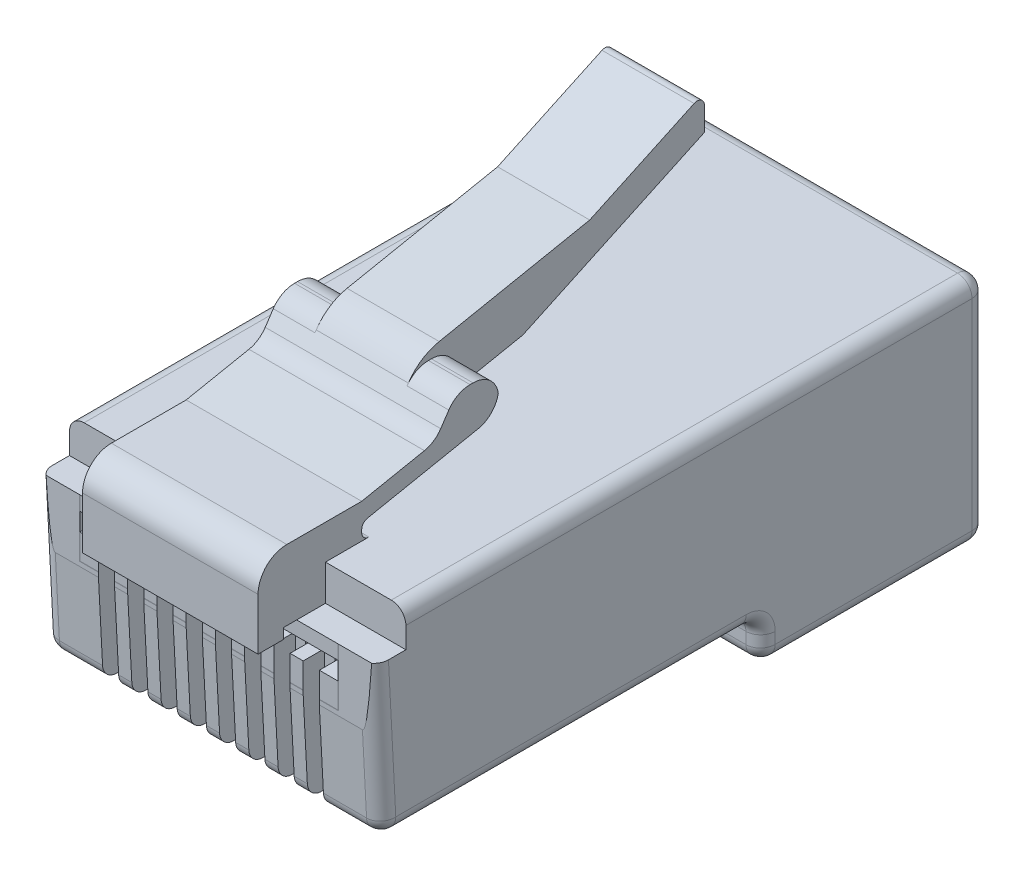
SolidWorks part; units mm, degrees
ref_plane "Front Plane" through (0, 0, 0) normal (0, 0, 1) x (1, 0, 0)
ref_plane "Top Plane" through (0, 0, 0) normal (0, 1, 0) x (1, 0, 0)
ref_plane "Right Plane" through (0, 0, 0) normal (1, 0, 0) x (0, 0, -1)
sketch "Sketch1" plane through (0, 0, 0) normal (1, 0, 0) x (0, 0, -1)
  line L0 (-10.5345, 0.6886) -> (-10.5345, 0.8486) construction
  line L2 (-9.5345, 4.0886) -> (-9.5345, 2.8486) construction
  line L3 (-9.5345, 2.8486) -> (-10.0345, 2.8486) construction
  line L4 (-10.0345, 2.8486) -> (-10.5345, 2.8486) construction
  line L5 (-10.5345, 0.8486) -> (-10.5345, 2.8486) construction
  line L6 (-10.5345, 0.6886) -> (-10.3916, -2.0376) construction
  line L7 (-9.8923, -2.5114) -> (2.2855, -2.5114) construction
  line L8 (2.7855, -3.0114) -> (2.7855, -3.4114) construction
  line L9 (3.2855, -3.9114) -> (10.1355, -3.9114) construction
  line L10 (10.6355, 3.5886) -> (10.6355, -3.4114) construction
  line L11 (-9.5345, 4.0886) -> (10.1355, 4.0886) construction
  line L12 (-10.5345, 2.8486) -> (10.6355, 2.8486) construction
  line L13 (6.7105, -3.9114) -> (6.7105, 4.0886) construction
  line L14 (6.7105, 0.0886) -> (-10.503, 0.0886) construction
  line L15 (-10.5345, 1.4758) -> (10.6355, 1.4758) construction
  arc A0 (-10.3916, -2.0376) -> (-9.8923, -2.5114) centre (-9.8923, -2.0114) ccw construction
  arc A1 (2.7855, -3.0114) -> (2.2855, -2.5114) centre (2.2855, -3.0114) ccw construction
  arc A2 (2.7855, -3.4114) -> (3.2855, -3.9114) centre (3.2855, -3.4114) ccw construction
  arc A3 (10.1355, -3.9114) -> (10.6355, -3.4114) centre (10.1355, -3.4114) ccw construction
  arc A4 (10.6355, 3.5886) -> (10.1355, 4.0886) centre (10.1355, 3.5886) ccw construction
  point P8 (0, 0)
  dimension "Length" = 21.17
  dimension "Height" = 8
sketch "Sketch2" plane through (0, 0, 0) normal (1, 0, 0) x (0, 0, -1)
  line L0 (3.2855, -3.9114) -> (10.1355, -3.9114) construction
  line L1 (10.6355, 3.5886) -> (10.6355, -3.4114) construction
  line L2 (-9.5345, 4.0886) -> (10.1355, 4.0886) construction
  line L3 (-9.5345, 4.0886) -> (-9.5345, 2.8486) construction
  line L4 (-9.5345, 2.8486) -> (-10.0345, 2.8486) construction
  line L5 (-10.0345, 2.8486) -> (-10.5345, 2.8486) construction
  line L6 (-10.5345, 0.8486) -> (-10.5345, 2.8486) construction
  line L7 (-10.5345, 0.6886) -> (-10.5345, 0.8486) construction
  line L8 (-10.5345, 0.6886) -> (-10.3916, -2.0376) construction
  line L9 (-9.8923, -2.5114) -> (2.2855, -2.5114) construction
  line L10 (2.7855, -3.0114) -> (2.7855, -3.4114) construction
  line L11 (10.6355, 3.5886) -> (10.6355, -3.4114)
  line L12 (-9.5345, 4.0886) -> (10.1355, 4.0886)
  line L13 (-9.5345, 4.0886) -> (-9.5345, 2.8486)
  line L14 (-9.5345, 2.8486) -> (-10.0345, 2.8486)
  line L15 (-10.0345, 2.8486) -> (-10.5345, 2.8486)
  line L16 (-10.5345, 0.8486) -> (-10.5345, 2.8486)
  line L17 (-10.5345, 0.6886) -> (-10.5345, 0.8486)
  line L18 (-10.5345, 0.6886) -> (-10.3916, -2.0376)
  line L19 (-9.8923, -2.5114) -> (2.2855, -2.5114)
  line L20 (2.7855, -3.0114) -> (2.7855, -3.4114)
  line L21 (3.2855, -3.9114) -> (10.1355, -3.9114)
  arc A0 (2.7855, -3.4114) -> (3.2855, -3.9114) centre (3.2855, -3.4114) ccw construction
  arc A1 (10.1355, -3.9114) -> (10.6355, -3.4114) centre (10.1355, -3.4114) ccw construction
  arc A2 (10.6355, 3.5886) -> (10.1355, 4.0886) centre (10.1355, 3.5886) ccw construction
  arc A3 (-10.3916, -2.0376) -> (-9.8923, -2.5114) centre (-9.8923, -2.0114) ccw construction
  arc A4 (2.7855, -3.0114) -> (2.2855, -2.5114) centre (2.2855, -3.0114) ccw construction
  arc A5 (10.1355, -3.9114) -> (10.6355, -3.4114) centre (10.1355, -3.4114) ccw
  arc A6 (10.6355, 3.5886) -> (10.1355, 4.0886) centre (10.1355, 3.5886) ccw
  arc A7 (-10.3916, -2.0376) -> (-9.8923, -2.5114) centre (-9.8923, -2.0114) ccw
  arc A8 (2.7855, -3.0114) -> (2.2855, -2.5114) centre (2.2855, -3.0114) ccw
  arc A9 (2.7855, -3.4114) -> (3.2855, -3.9114) centre (3.2855, -3.4114) ccw
extrude "Boss-Extrude1" add sketch "Sketch2" along normal mid plane 11.684
sketch "Sketch3" plane through (0, 0, 10.5345) normal (0, 0, 1) x (1, 0, 0)
  line L0 (5.842, 2.8486) -> (-5.842, 2.8486) construction
  line L1 (-4.4958, 2.8486) -> (4.4958, 2.8486)
  line L2 (-4.4958, 2.8486) -> (-4.4958, 0.842)
  line L3 (-4.4958, 0.842) -> (4.4958, 0.842)
  line L4 (4.4958, 2.8486) -> (4.4958, 0.842)
  line L5 (0, 0) -> (0, 4.0886) construction
  line L6 (5.842, 4.0886) -> (-5.842, 4.0886) construction
  dimension "D1" = 8.9916
  dimension "D2" = 2.0066
extrude "Boss-Extrude2" add sketch "Sketch3" along normal blind 0.0003
fillet "Fillet1" radius 0.508 3 edges at (-4.4958, 1.8453, 10.5347) (0, 0.842, 10.5347) (4.4958, 1.8453, 10.5347)
sketch "Sketch4" plane through (0, 0, 0) normal (1, 0, 0) x (0, 0, -1)
  line L0 (-10.9845, 2.8486) -> (-10.9845, 2.4886)
  line L1 (-10.5345, 2.8486) -> (-10.9845, 2.8486)
  line L2 (-10.0345, 2.8486) -> (-10.5345, 2.8486)
  line L3 (-9.5345, 2.8486) -> (-10.0345, 2.8486)
  line L4 (-9.5345, 2.8486) -> (-9.5345, 3.5886)
  line L5 (-9.5345, 4.0886) -> (-9.5345, 3.5886)
  line L6 (-8.0245, 4.0886) -> (-9.5345, 4.0886)
  line L7 (-8.2745, 4.436) -> (-8.2745, 4.3386)
  line L8 (-3.5145, 5.5886) -> (-8.0733, 4.6812)
  line L9 (-3.5145, 5.5886) -> (-1.2322, 6.0429)
  line L10 (-1.2322, 6.0429) -> (5.0755, 8.9842)
  line L11 (5.0755, 8.9842) -> (5.0755, 9.8055)
  line L12 (4.7199, 10.0321) -> (1.0936, 8.3411)
  line L13 (1.0936, 8.3411) -> (-4.8193, 7.1642)
  line L14 (-4.8193, 7.1642) -> (-5.7345, 5.7942)
  line L15 (-8.2745, 5.2886) -> (-5.7345, 5.7942)
  line L16 (-10.8745, 5.2886) -> (-8.2745, 5.2886)
  line L17 (-11.8745, 2.4886) -> (-11.8745, 4.2886)
  line L18 (-10.9845, 2.4886) -> (-11.8745, 2.4886)
  arc A0 (-8.2745, 4.3386) -> (-8.0245, 4.0886) centre (-8.0245, 4.3386) ccw
  arc A1 (-8.0733, 4.6812) -> (-8.2745, 4.436) centre (-8.0245, 4.436) ccw
  arc A2 (5.0755, 9.8055) -> (4.7199, 10.0321) centre (4.8255, 9.8055) ccw
  arc A3 (-10.8745, 5.2886) -> (-11.8745, 4.2886) centre (-10.8745, 4.2886) ccw
  point P27 (-9.5345, 2.8486)
extrude "Boss-Extrude3" add sketch "Sketch4" along normal mid plane 6.096 separate body
ref_plane "Plane1" through (0, 0, 3.5179) normal (0, 0, 1) x (1, 0, 0)
sketch "Sketch6" plane through (0, 0, 3.5179) normal (0, 0, 1) x (1, 0, 0)
  line L0 (0, 0) -> (0, 10.0321) construction
  line L1 (-1.6002, 0) -> (-5.842, 0)
  line L2 (-1.6002, 0) -> (-1.6002, 10.8902)
  line L3 (-1.6002, 10.8902) -> (-5.842, 10.8902)
  line L4 (-5.842, 0) -> (-5.842, 10.8902)
  line L5 (1.6002, 0) -> (5.842, 0)
  line L6 (1.6002, 0) -> (1.6002, 10.8902)
  line L7 (1.6002, 10.8902) -> (5.842, 10.8902)
  line L8 (5.842, 0) -> (5.842, 10.8902)
  line L9 (3.048, 10.0321) -> (-3.048, 10.0321) construction
  line L10 (5.842, 2.8486) -> (5.842, 0.6886) construction
  dimension "D1" = 3.2004
  dimension "D2" = 0.8581
extrude "Cut-Extrude1" cut sketch "Sketch6" against normal through all
sketch "Sketch8" plane through (0, -2.5114, 0) normal (0, -1, 0) x (1, 0, 0)
  line L0 (5.842, 10.5345) -> (-5.842, 10.5345) construction
  line L1 (-3.8354, 10.5599) -> (-3.2766, 10.5599)
  line L2 (-3.8354, 10.5599) -> (-3.8354, 5.6069)
  line L3 (-3.8354, 5.6069) -> (-3.2766, 5.6069)
  line L4 (-3.2766, 10.5599) -> (-3.2766, 5.6069)
  line L5 (-5.842, 9.8923) -> (-5.842, -2.2855) construction
  dimension "D1" = 4.953
  dimension "D2" = 0.5588
  dimension "D3" = 0.0254
  dimension "D4" = 2.0066
extrude "Cut-Extrude2" cut sketch "Sketch8" against normal blind 4.6927
pattern_linear "LPattern1" count 8 spacing 1.016 along (1, 0, 0) of "Cut-Extrude2"
ref_plane "Plane2" through (-3.556, 0, 0) normal (-1, 0, 0) x (0, 0, 1)
sketch "Sketch9" plane through (-3.556, 0, 0) normal (-1, 0, 0) x (0, 0, 1)
  line L0 (9.8923, -2.5114) -> (-2.2855, -2.5114) construction
  line L1 (5.6069, 1.7685) -> (9.8923, 1.7685)
  line L2 (5.6069, 1.7685) -> (5.6069, -2.5114)
  line L3 (5.6069, -2.5114) -> (9.8923, -2.5114)
  line L4 (9.8923, 1.7685) -> (9.8923, -2.5114)
  point P7 (9.8923, -2.5114)
  dimension "D1" = 4.2854
  dimension "D2" = 4.2799
extrude "Boss-Extrude4" add sketch "Sketch9" along normal mid plane 0.3556 separate body
fillet "Fillet2" radius 1.3017 2 edges at (-3.556, -2.5114, 5.6069) (-3.556, -2.5114, 9.8923)
pattern_linear "LPattern2" count 8 spacing 1.016 along (1, 0, 0)
fillet "Fillet3" radius 0.508 22 edges at (-5.842, -0.6745, 10.4631) (-5.842, -2.3741, 10.2365) (-5.842, -2.5114, 3.8034) (-5.842, -2.6579, -2.6391) (-5.842, -3.2114, -2.7855) (-5.842, -3.765, -2.932) (-5.842, -3.9114, -6.7105) (-5.842, -3.765, -10.4891) (-5.842, 4.0886, -0.3005) (-5.842, 3.9421, -10.4891) (5.842, -0.6745, 10.4631) (5.842, -2.3741, 10.2365) (5.842, -2.5114, 3.8034) (5.842, -2.6579, -2.6391) (5.842, -3.2114, -2.7855) (5.842, -3.765, -2.932) (5.842, 4.0886, -0.3005) (5.842, 3.9421, -10.4891) (5.842, 0.0886, -10.6355) (5.842, -3.765, -10.4891) (-5.842, 0.0886, -10.6355) (5.842, -3.9114, -6.7105)
sketch "Sketch10" plane through (0, 0, -10.6355) normal (0, 0, -1) x (-1, 0, 0)
  line L0 (0, 0) -> (0, 4.3386) construction
  line L1 (-4.6799, 3.4927) -> (4.6799, 3.4927)
  line L2 (-4.6799, 3.4927) -> (-4.68, -1.8413)
  line L3 (-4.68, -1.8413) -> (4.68, -1.8413)
  line L4 (4.6799, 3.4927) -> (4.68, -1.8413)
  line L5 (-3.048, 4.3386) -> (3.048, 4.3386) construction
  line L6 (-5.334, -3.9114) -> (5.334, -3.9114) construction
  dimension "D1" = 9.3599
  dimension "D2" = 5.334
  dimension "D3" = 2.0701
extrude "Cut-Extrude3" cut sketch "Sketch10" against normal blind 16.3671
sketch "Sketch11" plane through (0, 0, 10.5347) normal (0, 0, 1) x (1, 0, 0)
  line L0 (-4.4797, 2.8486) -> (-4.4797, 0.858) construction
  line L1 (-4.4797, 2.356) -> (4.4797, 2.356)
  line L2 (-4.4797, 2.356) -> (-4.4797, 1.7307)
  line L3 (-4.4797, 1.7307) -> (4.4797, 1.7307)
  line L4 (4.4797, 2.356) -> (4.4797, 1.7307)
  line L5 (4.4797, 0.858) -> (4.4797, 2.8486) construction
  dimension "D1" = 0.6253
  dimension "D2" = 0.1326
extrude "Cut-Extrude4" cut sketch "Sketch11" against normal through all both and the other way through all
sketch "Sketch12" plane through (0, -3.9114, 0) normal (0, -1, 0) x (1, 0, 0)
  line L0 (0, 0) -> (0, -10.6355) construction
  line L1 (-4.0005, -4.9205) -> (4.0005, -4.9205)
  line L2 (-4.0005, -4.9205) -> (-4.0005, -8.1209)
  line L3 (-4.0005, -8.1209) -> (4.0005, -8.1209)
  line L4 (4.0005, -4.9205) -> (4.0005, -8.1209)
  line L5 (5.334, -10.6355) -> (-5.334, -10.6355) construction
  dimension "D1" = 8.001
  dimension "D2" = 3.2004
  dimension "D3" = 2.5146
extrude "Cut-Extrude5" cut sketch "Sketch12" against normal blind 1.7621
sketch "Sketch13" plane through (0, 0, 0) normal (1, 0, 0) x (0, 0, -1)
  line L0 (5.4945, -2.1493) -> (7.5469, -2.1493)
  line L1 (8.1209, -2.1493) -> (4.9205, -2.1493) construction
  line L2 (7.5469, -2.1493) -> (6.7105, -3.9114)
  line L3 (10.1355, -3.9114) -> (3.2855, -3.9114) construction
  line L4 (6.7105, -3.9114) -> (5.4945, -2.1493)
  line L5 (8.1209, -3.0304) -> (4.9205, -3.0304) construction
  line L6 (8.1209, -2.1493) -> (8.1209, -3.9114) construction
  line L7 (4.9205, -2.1493) -> (4.9205, -3.9114) construction
  point P13 (6.5207, -2.1493)
  point P14 (6.5207, -3.0304)
  dimension "D1" = 60
extrude "Boss-Extrude5" add sketch "Sketch13" along normal mid plane 7.3977
fillet "Fillet4" radius 0.381 1 edges at (0, -3.9114, -6.7105)
sketch "Sketch14" plane through (0, 0, 11.8745) normal (0, 0, 1) x (1, 0, 0)
  line L0 (0, 5.7942) -> (0, 10.0321) construction
  line L1 (-3.048, 7.4232) -> (-1.778, 7.4232)
  line L2 (-3.048, 7.4232) -> (-3.048, 6.9152)
  line L3 (-3.048, 6.9152) -> (-1.778, 6.9152)
  line L4 (-1.778, 7.4232) -> (-1.778, 6.9152)
  line L5 (3.048, 7.4232) -> (1.778, 7.4232)
  line L6 (3.048, 7.4232) -> (3.048, 6.9152)
  line L9 (3.048, 5.7942) -> (-3.048, 5.7942) construction
  line L10 (1.6002, 10.0321) -> (-1.6002, 10.0321) construction
  line L11 (3.048, 6.9152) -> (1.778, 6.9152)
  line L12 (1.778, 6.9152) -> (1.778, 7.4232)
  dimension "D1" = 1.27
  dimension "D2" = 0.508
extrude "Cut-Extrude6" cut sketch "Sketch14" against normal through all
fillet "Fillet5" radius 0.889 6 edges at (-2.413, 6.9152, 3.5179) (2.413, 6.9152, 3.5179) (2.413, 6.9152, 4.9856) (-2.413, 6.9152, 4.9856) (-2.3241, 5.5879, 3.5179) (2.3241, 5.5879, 3.5179)
fillet "Fillet6" radius 0.889 1 edges at (0, 5.7942, 5.7345)
fillet "Fillet7" radius 1.6827 1 edges at (0, 7.1642, 4.8193)
other "Move Face1" parameters "D1"=0.1778
other "Move Face2" parameters "D1"=0.1778
